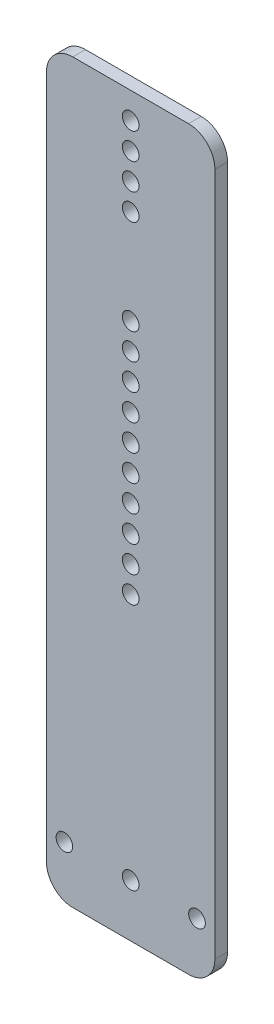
SolidWorks part; units mm, degrees
ref_plane "Front Plane" through (0, 0, 0) normal (0, 0, 1) x (1, 0, 0)
ref_plane "Top Plane" through (0, 0, 0) normal (0, 1, 0) x (1, 0, 0)
ref_plane "Right Plane" through (0, 0, 0) normal (1, 0, 0) x (0, 0, -1)
sketch "Sketch1" plane through (0, 0, 0) normal (0, 0, 1) x (1, 0, 0)
  line L1 (-20.32, 88.9) -> (20.32, 88.9)
  line L2 (-20.32, 88.9) -> (-20.32, -88.9)
  line L3 (-20.32, -88.9) -> (20.32, -88.9)
  line L4 (20.32, 88.9) -> (20.32, -88.9)
  line L5 (-20.32, 88.9) -> (20.32, -88.9) construction
  line L6 (-20.32, -88.9) -> (20.32, 88.9) construction
  point P0 (0, 0)
  dimension "D1" = 177.8
  dimension "D2" = 40.64
extrude "Boss-Extrude1" add sketch "Sketch1" along normal blind 3.048
sketch "Sketch2" plane through (0, 0, 3.048) normal (0, 0, 1) x (1, 0, 0)
  line L0 (-20.32, -88.9) -> (20.32, -88.9) construction
  circle A0 centre (0, -76.2) radius 2.0066
  circle A1 centre (0, 82.55) radius 2.0066
  circle A2 centre (0, 76.2) radius 2.0066
  circle A3 centre (0, 69.85) radius 2.0066
  circle A4 centre (0, 63.5) radius 2.0066
  circle A5 centre (16.002, -76.2) radius 2.0066
  circle A6 centre (-16.002, -76.2) radius 2.0066
  dimension "D1" = 4.0132
  dimension "D3" = 4.0132
  dimension "D4" = 158.75
  dimension "D2" = 12.7
  dimension "D5" = 4
  dimension "D6" = 2
  dimension "D7" = 2
extrude "Cut-Extrude1" cut sketch "Sketch2" against normal blind 3.048
sketch "Sketch3" plane through (0, 0, 3.048) normal (0, 0, 1) x (1, 0, 0)
  line L0 (-20.32, -88.9) -> (20.32, -88.9) construction
  circle A0 centre (0, -16.4846) radius 2.0193
  circle A1 centre (0, -10.1346) radius 2.0193
  circle A2 centre (0, -3.7846) radius 2.0193
  circle A3 centre (0, 2.5654) radius 2.0193
  circle A4 centre (0, 8.9154) radius 2.0193
  circle A5 centre (0, 15.2654) radius 2.0193
  circle A6 centre (0, 21.6154) radius 2.0193
  circle A7 centre (0, 27.9654) radius 2.0193
  circle A8 centre (0, 34.3154) radius 2.0193
  circle A9 centre (0, 40.6654) radius 2.0193
  dimension "D1" = 4.0386
  dimension "D2" = 72.4154
  dimension "D3" = 10
extrude "Cut-Extrude2" cut sketch "Sketch3" against normal through all
fillet "Fillet1" radius 6.35 4 edges at (20.32, -88.9, 1.524) (-20.32, -88.9, 1.524) (20.32, 88.9, 1.524) (-20.32, 88.9, 1.524)
equation "\"thickness_acrylic0.1\"=0.1in"
equation "\"motor offset\"=6mm"
equation "\"thickness0.25\"=0.225in"
equation "\"thickness0.125\"=0.122in"
